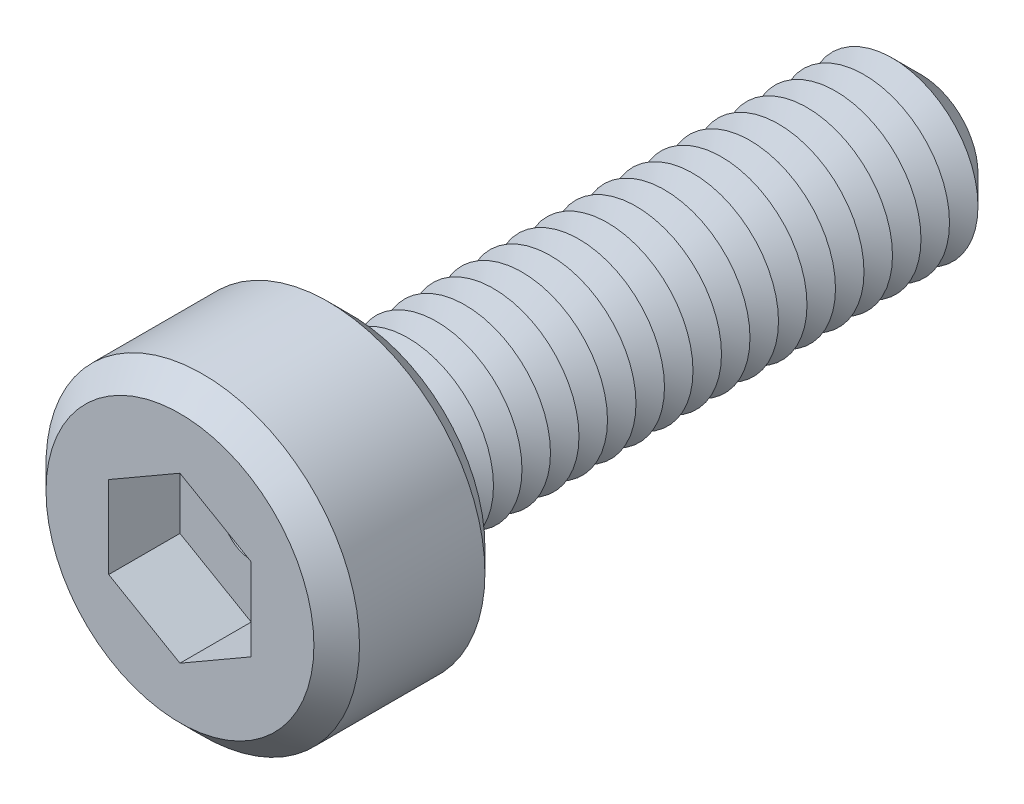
SolidWorks part; units mm, degrees
ref_plane "Front Plane" through (0, 0, 0) normal (0, 0, 1) x (1, 0, 0)
ref_plane "Top Plane" through (0, 0, 0) normal (0, 1, 0) x (1, 0, 0)
ref_plane "Right Plane" through (0, 0, 0) normal (1, 0, 0) x (0, 0, -1)
sketch "Sketch1" plane through (0, 0, 0) normal (0, 0, 1) x (1, 0, 0)
  circle A0 centre (0, 0) radius 2.75
  dimension "D1" = 5.5
extrude "Boss-Extrude1" add sketch "Sketch1" along normal blind 3
sketch "Sketch2" plane through (0, 0, 0) normal (0, 0, -1) x (-1, 0, 0)
  circle A0 centre (0, 0) radius 1.5
  dimension "D1" = 3
extrude "Boss-Extrude2" add sketch "Sketch2" along normal blind 10
chamfer "Chamfer1" distance 0.5 angle 45 1 edges at (-1.5, 0, -10)
sketch "Sketch3" plane through (0, 0, 0) normal (1, 0, 0) x (0, 0, -1)
  line L0 (-2.5121, 0) -> (4.5776, 0) construction
sketch "Sketch4" plane through (0, 0, 0) normal (1, 0, 0) x (0, 0, -1)
  line L0 (0, 1.5) -> (0.25, 1.067)
  line L1 (0.25, 1.067) -> (0.5, 1.5)
  line L2 (9.5, 1.5) -> (0, 1.5) construction
  line L3 (0.5, 1.5) -> (0, 1.5)
  dimension "D1" = 0.5
revolve "Cut-Revolve1" cut sketch "Sketch4" angle 360 about L0
pattern_linear "LPattern1" count 19 spacing 0.5 along (0, 0, -1) of "Cut-Revolve1"
sketch "Sketch5" plane through (0, 0, 3) normal (0, 0, 1) x (1, 0, 0)
  line L1 (0, 1.4434) -> (-1.25, 0.7217)
  line L2 (-1.25, 0.7217) -> (-1.25, -0.7217)
  line L3 (-1.25, -0.7217) -> (0, -1.4434)
  line L4 (0, -1.4434) -> (1.25, -0.7217)
  line L5 (1.25, -0.7217) -> (1.25, 0.7217)
  line L6 (1.25, 0.7217) -> (0, 1.4434)
  circle A0 centre (0, 0) radius 1.25 construction
  dimension "D1" = 2.5
extrude "Cut-Extrude1" cut sketch "Sketch5" against normal blind 1.25
sketch "Sketch6" plane through (0, 0, 1.75) normal (0, 0, 1) x (1, 0, 0)
  circle A0 centre (0, 0) radius 0.5
  dimension "D1" = 1
extrude "Cut-Extrude2" cut sketch "Sketch6" against normal up to surface (11.75 mm away)
chamfer "Chamfer2" distance 0.4 angle 45 2 edges at (2.75, 0, 0) (2.75, 0, 3)
